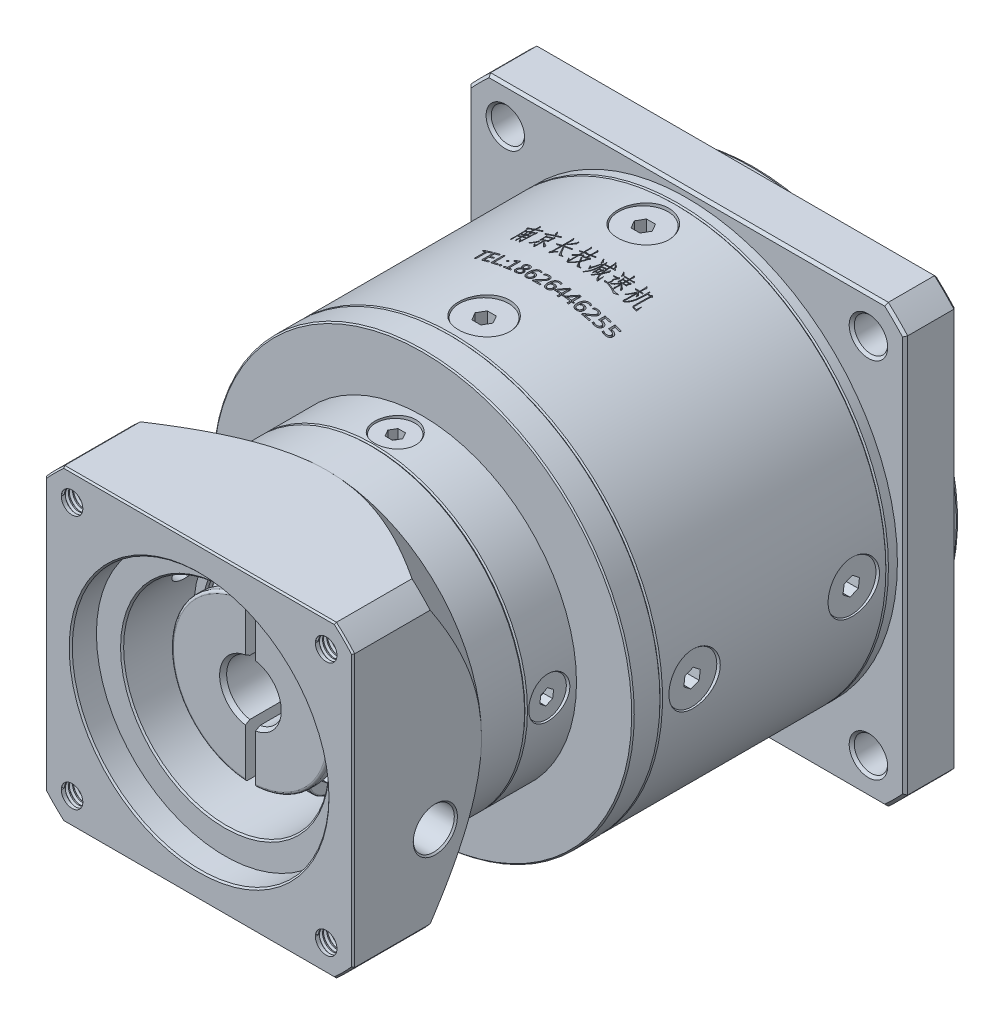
SolidWorks part; units mm, degrees
ref_plane "前视基准面" through (0, 0, 0) normal (0, 0, 1) x (1, 0, 0)
ref_plane "上视基准面" through (0, 0, 0) normal (0, 1, 0) x (1, 0, 0)
ref_plane "右视基准面" through (0, 0, 0) normal (1, 0, 0) x (0, 0, -1)
imported_body "11-50-70-M5-1-solid1"
imported_body "11-50-70-M5-1-solid2"
imported_body "11-50-70-M5-1-solid3"
imported_body "11-50-70-M5-1-solid4"
imported_body "11-50-70-M5-1-solid5"
imported_body "ZF80-K15-L2-F60-5-solid1"
imported_body "ZF80-K15-L2-F60-5-solid2"
imported_body "ZF80-K15-L2-F60-5-solid3"
imported_body "ZF80-K15-L2-F60-5-solid4"
imported_body "ZF80-K15-L2-F60-5-solid5"
imported_body "ZF80-K15-L2-F60-5-solid6"
imported_body "ZF80-K15-L2-F60-5-solid7"
imported_body "ZF80-K15-L2-F60-5-solid8"
imported_body "ZF80-K15-L2-F60-5-solid9"
imported_body "ZF80-K15-L2-F60-5-solid10"
imported_body "ZF80-K15-L2-F60-5-solid11"
imported_body "ZF80-K15-L2-F60-5-solid12"
imported_body "ZF80-K15-L2-F60-5-solid13"
sketch "草图1" plane through (0, 0, -59.8936) normal (0, 0, -1) x (-1, 0, 0)
  circle A0 centre (63.8706, 20.5839) radius 10.876
  dimension "D1" = 21.7519
extrude "凸台-拉伸1" add sketch "草图1" along normal blind 5
